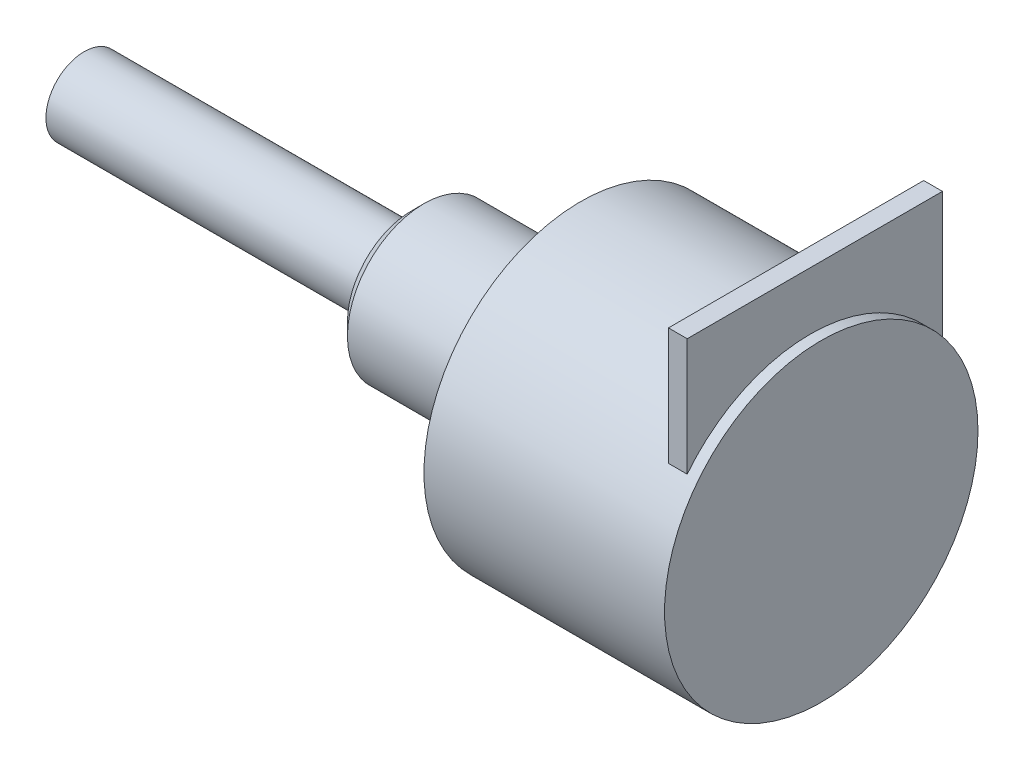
SolidWorks part; units mm, degrees
ref_plane "Front" through (0, 0, 0) normal (0, 0, 1) x (1, 0, 0)
ref_plane "Top" through (0, 0, 0) normal (0, 1, 0) x (1, 0, 0)
ref_plane "Right" through (0, 0, 0) normal (1, 0, 0) x (0, 0, -1)
sketch "Sketch1" plane through (0, 0, 0) normal (0, 0, 1) x (1, 0, 0)
  line L0 (0, 0) -> (-62.2826, 0) construction
  line L1 (0, 0) -> (0, 6.5024)
  line L2 (0, 6.5024) -> (-9.9822, 6.5024)
  line L3 (-9.9822, 6.5024) -> (-9.9822, 3.175)
  line L4 (-9.9822, 3.175) -> (-16.9926, 3.175)
  line L5 (-16.9926, 3.175) -> (-16.9926, 1.5875)
  line L6 (-16.9926, 1.5875) -> (-30.5816, 1.5875)
  line L7 (-30.5816, 1.5875) -> (-30.5816, 0)
  line L8 (-30.5816, 0) -> (0, 0)
  dimension "D1" = 3.175
  dimension "D2" = 6.35
  dimension "D3" = 13.0048
  dimension "D4" = 9.9822
  dimension "D5" = 7.0104
  dimension "D6" = 20.5994
revolve "Revolve1" add sketch "Sketch1" angle 360 about L0
sketch "Sketch3" plane through (0, 0, 0) normal (0, 1, 0) x (1, 0, 0)
  line L1 (-1.2318, 5.4815) -> (-0.4536, 5.4815)
  line L2 (-1.2318, 5.4815) -> (-1.2318, -5.1093)
  line L3 (-1.2318, -5.1093) -> (-0.4536, -5.1093)
  line L4 (-0.4536, 5.4815) -> (-0.4536, -5.1093)
extrude "Extrude1" add sketch "Sketch3" along normal blind 8.89
chamfer "Chamfer1" distance 0.508 angle 45 1 edges at (-16.9926, 0, -3.175)
